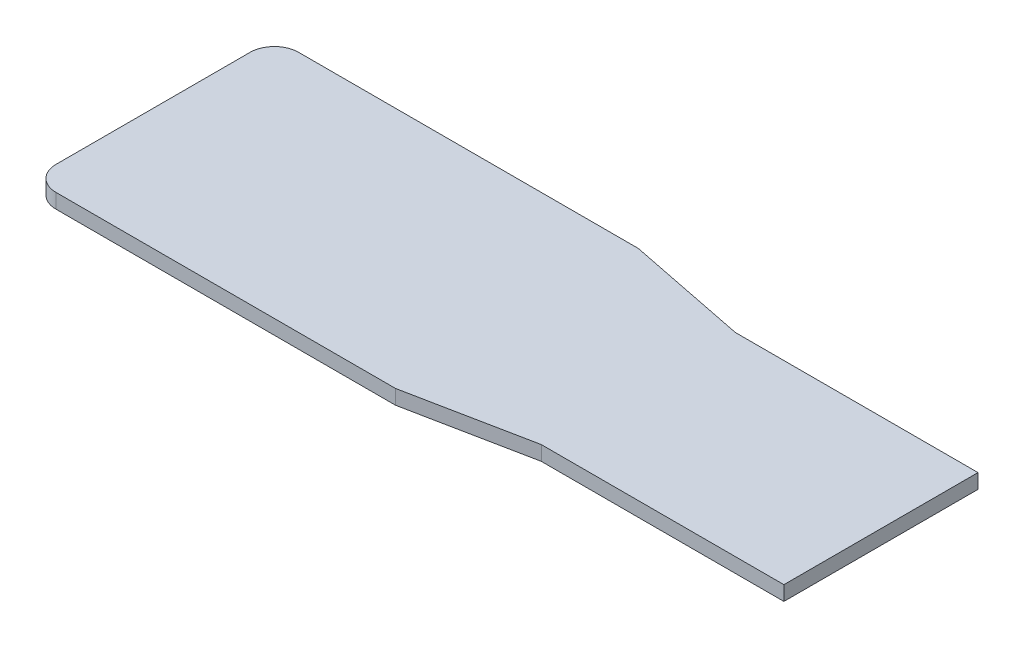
SolidWorks part; units mm, degrees
ref_plane "Front" through (0, 0, 0) normal (0, 0, 1) x (1, 0, 0)
ref_plane "Top" through (0, 0, 0) normal (0, 1, 0) x (1, 0, 0)
ref_plane "Right" through (0, 0, 0) normal (1, 0, 0) x (0, 0, -1)
sketch "Sketch1" plane through (0, 0, 0) normal (0, 1, 0) x (1, 0, 0)
  line L0 (19.05, 6.35) -> (25.4, 5.08)
  line L1 (1.27, 6.35) -> (19.05, 6.35)
  line L2 (0, 5.08) -> (0, -5.08)
  line L3 (1.27, -6.35) -> (19.05, -6.35)
  line L5 (25.4, 5.08) -> (38.1, 5.08)
  line L6 (38.1, 5.08) -> (38.1, -5.08)
  line L7 (38.1, -5.08) -> (25.4, -5.08)
  line L8 (25.4, -5.08) -> (19.05, -6.35)
  arc A0 (0, -5.08) -> (1.27, -6.35) centre (1.27, -5.08) ccw
  arc A1 (1.27, 6.35) -> (0, 5.08) centre (1.27, 5.08) ccw
  point P4 (0, 0)
  point P6 (38.1, 0)
  point P11 (16.9711, 6.35)
  point P12 (0, 0)
  point P15 (0, -6.35)
  point P18 (0, 6.35)
  dimension "D6" = 1.27
  dimension "D1" = 12.7
  dimension "D2" = 19.05
  dimension "D3" = 10.16
  dimension "D4" = 6.35
  dimension "D5" = 38.1
extrude "Boss-Extrude1" add sketch "Sketch1" along normal blind 0.762
